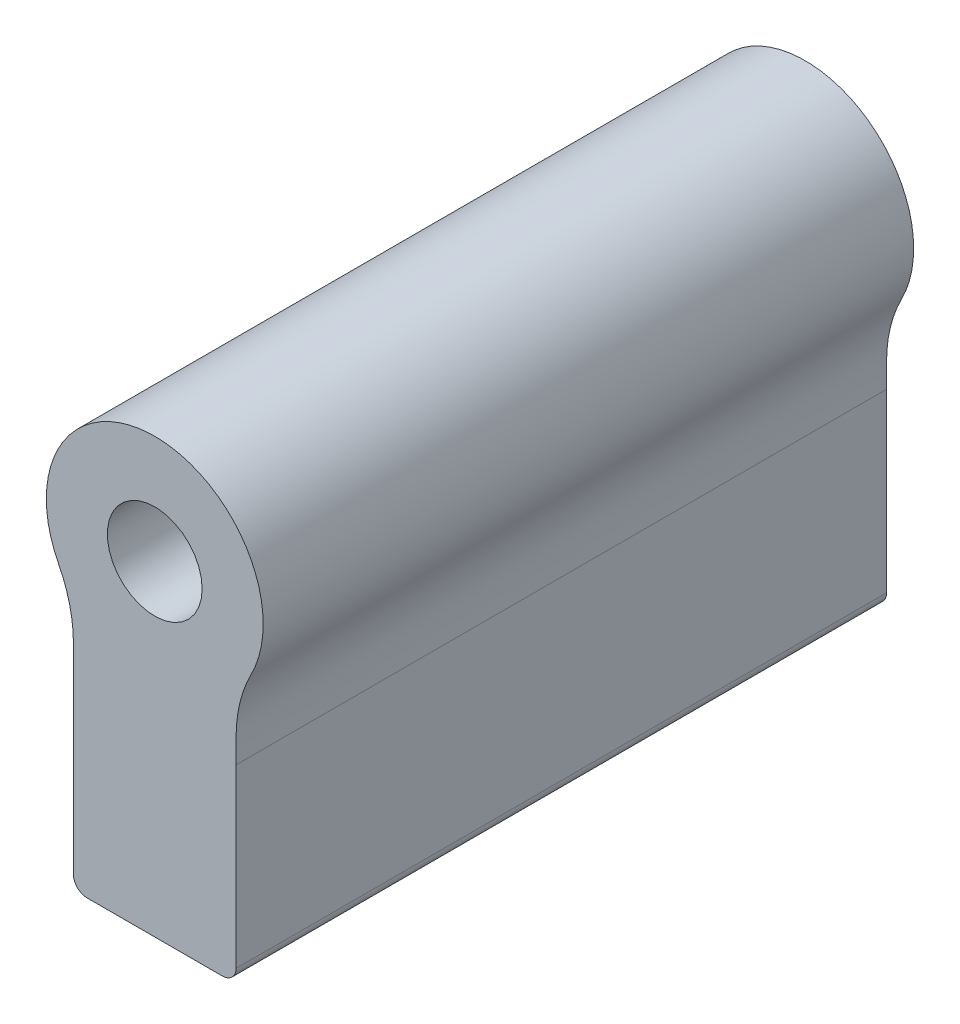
SolidWorks part; units mm, degrees
ref_plane "Alzado" through (0, 0, 0) normal (0, 0, 1) x (1, 0, 0)
ref_plane "Planta" through (0, 0, 0) normal (0, 1, 0) x (1, 0, 0)
ref_plane "Vista lateral" through (0, 0, 0) normal (1, 0, 0) x (0, 0, -1)
other "Graphic1"
other "Graphic (Closed) -1"
imported_body "Imported1"
other "Convert Mesh to Standard1"
sketch "Sketch1" plane through (0, 0, 24) normal (0, 0, 1) x (1, 0, 0)
  line L0 (-4.2456, -12) -> (5.58, -12) construction
  line L1 (-3.0022, -5) -> (3.0022, -5)
  line L2 (-3.0022, -5) -> (-3.0022, -11.5)
  line L3 (-2.5022, -12) -> (2.5022, -12)
  line L4 (3.0022, -5) -> (3.0022, -11.5)
  line L5 (-3.0022, -5) -> (3.0022, -12) construction
  line L6 (-3.0022, -12) -> (3.0022, -5) construction
  arc A0 (3.0022, -11.5) -> (2.5022, -12) centre (2.5022, -11.5) cw
  arc A1 (-3.0022, -11.5) -> (-2.5022, -12) centre (-2.5022, -11.5) ccw
  spline S0 degree 3 number of poles 111 (3, -5.9887) -> (3, -5.9887) construction
  point P0 (0, -8.5)
  dimension "D3" = 0.5
  dimension "D1" = 12
  dimension "D2" = 7
extrude "Boss-Extrude1" add sketch "Sketch1" against normal up to surface (24 mm away)
